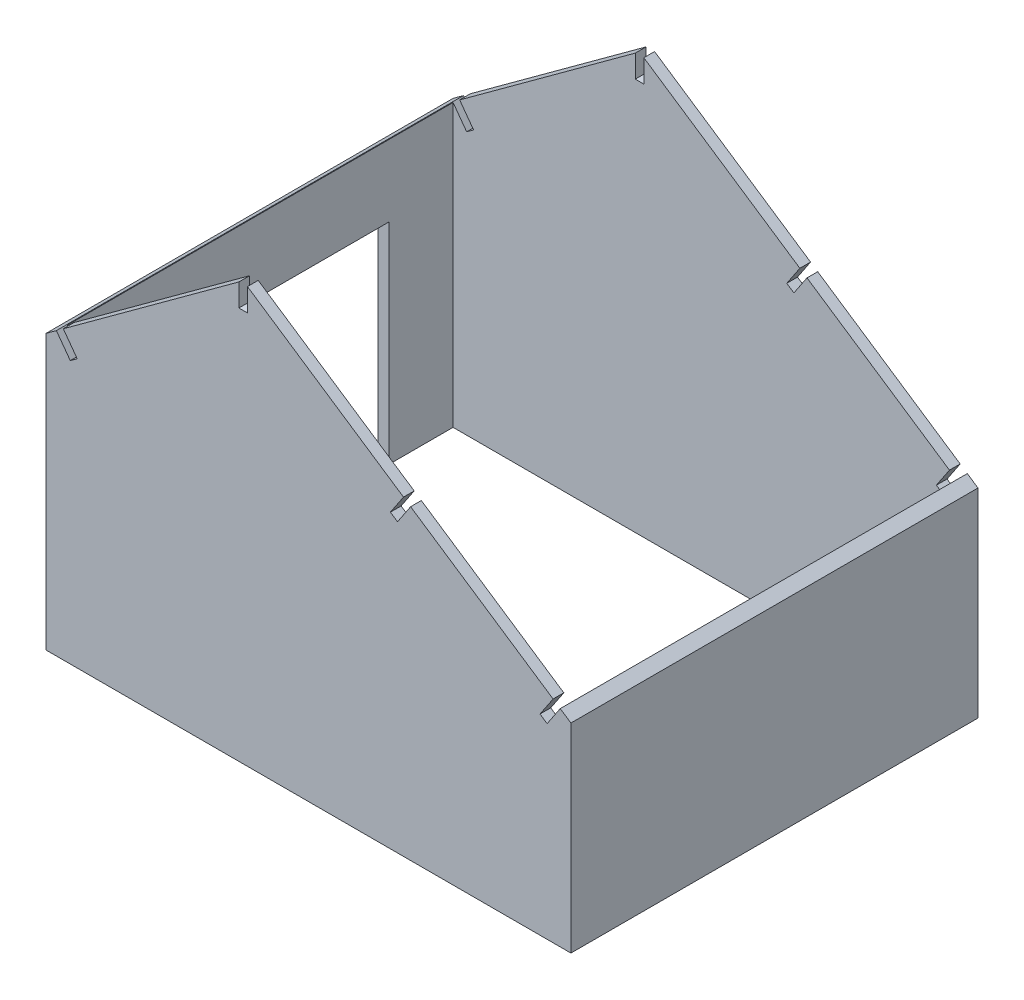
SolidWorks part; units mm, degrees
ref_plane "Plan de face" through (0, 0, 0) normal (0, 0, 1) x (1, 0, 0)
ref_plane "Plan de dessus" through (0, 0, 0) normal (0, 1, 0) x (1, 0, 0)
ref_plane "Plan de droite" through (0, 0, 0) normal (1, 0, 0) x (0, 0, -1)
sketch "Esquisse1" plane through (0, 0, 0) normal (0, 0, 1) x (1, 0, 0)
  line L0 (-92.0383, 55.1138) -> (-92.0383, -72.8862)
  line L1 (-92.0383, -72.8862) -> (152.9617, -72.8862)
  line L2 (152.9617, -72.8862) -> (152.9617, 20.1138)
  line L3 (152.9617, 20.1138) -> (0, 122.3816)
  line L4 (0, 122.3816) -> (-92.0383, 55.1138)
  dimension "D1" = 245
  dimension "D2" = 93
  dimension "D3" = 128
  dimension "D4" = 114
  dimension "D5" = 184
extrude "Extrusion1" add sketch "Esquisse1" against normal blind 5
sketch "Esquisse2" plane through (0, 0, -5) normal (0, 0, -1) x (-1, 0, 0)
  line L0 (-152.9617, 20.1138) -> (0, 122.3816) construction
  line L2 (-152.9617, -72.8862) -> (-152.9617, 20.1138) construction
  line L3 (-152.9617, 20.1138) -> (-147.9617, 23.4567)
  line L4 (92.0383, -72.8862) -> (-152.9617, -72.8862) construction
  line L5 (-152.9617, -72.8862) -> (-152.9617, 20.1138)
  line L6 (-147.9617, 23.4567) -> (-147.9617, -72.8862)
  line L7 (92.0383, 55.1138) -> (92.0383, -72.8862) construction
  line L8 (0, 122.3816) -> (92.0383, 55.1138) construction
  line L9 (92.0383, -72.8862) -> (87.0383, -72.8862)
  line L10 (92.0383, 55.1138) -> (92.0383, -72.8862)
  line L11 (87.0383, 58.7682) -> (92.0383, 55.1138)
  line L12 (87.0383, 58.7682) -> (87.0383, -72.8862)
  line L13 (-147.9617, -72.8862) -> (-152.9617, -72.8862)
  dimension "D1" = 5
  dimension "D2" = 5
extrude "Extrusion3" add sketch "Esquisse2" along normal blind 180
sketch "Esquisse3" plane through (0, 0, -185) normal (0, 0, -1) x (-1, 0, 0)
  line L0 (0, 122.3816) -> (87.0383, 58.7682) construction
  line L1 (92.0383, 55.1138) -> (87.0383, 58.7682) construction
  line L2 (92.0383, -72.8862) -> (92.0383, 55.1138) construction
  line L3 (87.0383, -72.8862) -> (92.0383, -72.8862) construction
  line L4 (87.0383, -72.8862) -> (-147.9617, -72.8862) construction
  line L5 (-152.9617, -72.8862) -> (-147.9617, -72.8862) construction
  line L6 (-147.9617, 23.4567) -> (-152.9617, 20.1138) construction
  line L7 (-147.9617, 23.4567) -> (0, 122.3816) construction
  line L8 (-152.9617, 20.1138) -> (-152.9617, -72.8862) construction
  line L9 (0, 122.3816) -> (87.0383, 58.7682)
  line L10 (92.0383, 55.1138) -> (87.0383, 58.7682)
  line L11 (92.0383, -72.8862) -> (92.0383, 55.1138)
  line L12 (87.0383, -72.8862) -> (92.0383, -72.8862)
  line L13 (87.0383, -72.8862) -> (-147.9617, -72.8862)
  line L14 (-152.9617, -72.8862) -> (-147.9617, -72.8862)
  line L15 (-147.9617, 23.4567) -> (-152.9617, 20.1138)
  line L16 (-147.9617, 23.4567) -> (0, 122.3816)
  line L17 (-152.9617, 20.1138) -> (-152.9617, -72.8862)
extrude "Extrusion4" add sketch "Esquisse3" along normal blind 5
sketch "Esquisse4" plane through (-92.0383, 0, 0) normal (-1, 0, 0) x (0, 0, 1)
  line L0 (-190, -72.8862) -> (0, -72.8862) construction
  line L1 (-35, -72.8862) -> (-155, -72.8862)
  line L2 (-35, -72.8862) -> (-35, 25.1138)
  line L3 (-35, 25.1138) -> (-155, 25.1138)
  line L4 (-155, -72.8862) -> (-155, 25.1138)
  line L5 (0, 55.1138) -> (0, -72.8862) construction
  line L6 (-190, -72.8862) -> (-190, 55.1138) construction
  line L7 (-190, 55.1138) -> (0, 55.1138) construction
  dimension "D1" = 35
  dimension "D2" = 35
  dimension "D3" = 30
extrude "Enlèv. mat.-Extru.1" cut sketch "Esquisse4" against normal blind 5
sketch "Esquisse5" plane through (-58.3018, 79.7707, 0) normal (-0.5901, 0.8074, 0) x (-0.8074, -0.5901, 0)
  line L0 (41.7864, -190) -> (41.7864, 0) construction
  line L1 (31.7864, 4.9934) -> (35.7864, 4.9934)
  line L2 (31.7864, 4.9934) -> (31.7864, -203.6885)
  line L3 (31.7864, -203.6885) -> (35.7864, -203.6885)
  line L4 (35.7864, 4.9934) -> (35.7864, -203.6885)
  dimension "D1" = 4
  dimension "D2" = 6
extrude "Enlèv. mat.-Extru.2" cut sketch "Esquisse5" against normal blind 11
sketch "Esquisse6" plane through (56.5461, 84.5758, 0) normal (0.5558, 0.8313, 0) x (-0.8313, 0.5558, 0)
  line L0 (-115.9799, -190) -> (-115.9799, 0) construction
  line L1 (-109.9799, 5.8625) -> (-105.9799, 5.8625)
  line L2 (-109.9799, 5.8625) -> (-109.9799, -203.0266)
  line L3 (-109.9799, -203.0266) -> (-105.9799, -203.0266)
  line L4 (-105.9799, 5.8625) -> (-105.9799, -203.0266)
  line L6 (-25.9799, 5.8625) -> (-21.9799, 5.8625)
  line L7 (-25.9799, 5.8625) -> (-25.9799, -203.0266)
  line L8 (-25.9799, -203.0266) -> (-21.9799, -203.0266)
  line L9 (-21.9799, 5.8625) -> (-21.9799, -203.0266)
  dimension "D1" = 4
  dimension "D2" = 6
  dimension "D3" = 4
  dimension "D4" = 80
extrude "Enlèv. mat.-Extru.3" cut sketch "Esquisse6" against normal blind 11
ref_plane "Plan1" through (0, 122.3816, 0) normal (0, -1, 0) x (1, 0, 0)
sketch "Esquisse7" plane through (0, 122.3816, 0) normal (0, -1, 0) x (1, 0, 0)
  line L1 (-2, -194.7932) -> (2, -194.7932)
  line L2 (-2, -194.7932) -> (-2, 7.4064)
  line L3 (-2, 7.4064) -> (2, 7.4064)
  line L4 (2, -194.7932) -> (2, 7.4064)
  point P4 (0, -194.7932)
  dimension "D1" = 4
extrude "Enlèv. mat.-Extru.5" cut sketch "Esquisse7" along normal blind 12
